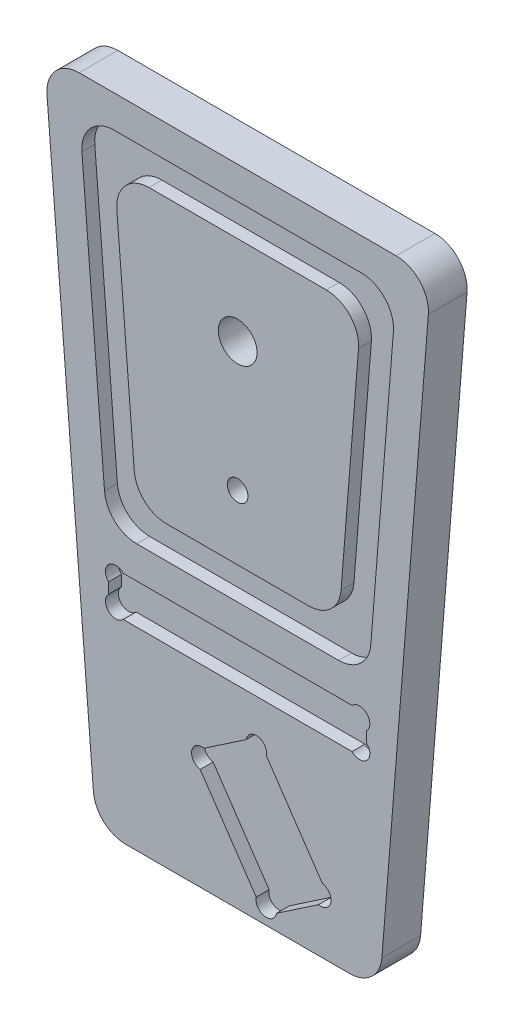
SolidWorks part; units mm, degrees
ref_plane "Plan de face" through (0, 0, 0) normal (0, 0, 1) x (1, 0, 0)
ref_plane "Plan de dessus" through (0, 0, 0) normal (0, 1, 0) x (1, 0, 0)
ref_plane "Plan de droite" through (0, 0, 0) normal (1, 0, 0) x (0, 0, -1)
sketch "Esquisse1" plane through (0, 0, 0) normal (0, 0, 1) x (1, 0, 0)
  line L0 (-22, -40) -> (-30, 60)
  line L1 (-30, 60) -> (30, 60)
  line L2 (0, -55) -> (0, 55) construction
  line L3 (-22, -40) -> (22, -40)
  line L4 (0, 70) -> (0, -50) construction
  line L5 (22, -40) -> (30, 60)
  point P10 (0, -40)
  point P11 (0, 60)
  dimension "D1" = 30
  dimension "D2" = 22
  dimension "D3" = 100
extrude "Extrusion1" add sketch "Esquisse1" along normal blind 6
fillet "Congé1" radius 5 3 edges at (-22, -40, 3) (-30, 60, 3) (30, 60, 3)
sketch "Esquisse3" plane through (0, 0, 6) normal (0, 0, 1) x (1, 0, 0)
  line L0 (20, -3.8) -> (-20, -3.8)
  line L1 (-20, -3.8) -> (-20, -10)
  line L2 (-20, -10) -> (20, -10)
  line L3 (-17.384, -40) -> (22, -40) construction
  line L4 (0, 70) -> (0, -50) construction
  line L5 (20, -3.8) -> (20, -10)
  point P10 (0, -10)
  point P11 (0, -3.8)
  dimension "D1" = 30
  dimension "D2" = 6.2
  dimension "D3" = 20
extrude "Enlèv. mat.-Extru.1" cut sketch "Esquisse3" against normal blind 2
sketch "Esquisse5" plane through (0, 0, 6) normal (0, 0, 1) x (1, 0, 0)
  line L0 (24.584, 55) -> (-24.584, 55)
  line L1 (-24.584, 55) -> (-20.28, 1.2)
  line L2 (-20.28, 1.2) -> (20.28, 1.2)
  line L3 (19.1681, 50) -> (-19.1681, 50)
  line L4 (-19.1681, 50) -> (-15.6641, 6.2)
  line L5 (-15.6641, 6.2) -> (15.6641, 6.2)
  line L6 (24.584, 60) -> (-24.584, 60) construction
  line L7 (-29.5681, 54.6013) -> (-22.3681, -35.3987) construction
  line L9 (20, -3.8) -> (-20, -3.8) construction
  line L10 (0, 70) -> (0, -50) construction
  line L11 (19.1681, 50) -> (15.6641, 6.2)
  line L12 (24.584, 55) -> (20.28, 1.2)
  point P19 (0, 6.2)
  point P20 (0, 50)
  point P21 (0, 1.2)
  point P22 (0, 55)
  dimension "D1" = 5
  dimension "D2" = 5
  dimension "D3" = 5
  dimension "D4" = 5
  dimension "D5" = 5
  dimension "D6" = 5
  dimension "D7" = 5
  dimension "D8" = 5
extrude "Enlèv. mat.-Extru.3" cut sketch "Esquisse5" against normal blind 2
fillet "Congé2" radius 5 8 edges at (-20.28, 1.2, 5) (-24.584, 55, 5) (24.584, 55, 5) (20.28, 1.2, 5) (-19.1681, 50, 5) (19.1681, 50, 5) (15.6641, 6.2, 5) (-15.6641, 6.2, 5)
sketch "Esquisse4" plane through (0, 0, 6) normal (0, 0, 1) x (1, 0, 0)
  line L0 (20, -3.8) -> (-20, -3.8) construction
  circle A0 centre (0, 16.2) radius 1.6
  circle A1 centre (0, 36.2) radius 3
  dimension "D1" = 6
  dimension "D2" = 3.2
  dimension "D3" = 20
  dimension "D4" = 40
extrude "Enlèv. mat.-Extru.2" cut sketch "Esquisse4" against normal blind 6
sketch "Esquisse6" plane through (0, 0, 6) normal (0, 0, 1) x (1, 0, 0)
  line L0 (-7.0801, -22.3005) -> (3.1805, -15.3379)
  line L1 (3.1805, -15.3379) -> (14.4107, -31.8873)
  line L2 (14.4107, -31.8873) -> (4.15, -38.85)
  line L3 (4.15, -38.85) -> (-7.0801, -22.3005)
  line L4 (-17.384, -40) -> (22, -40) construction
  line L5 (3.1805, -15.3379) -> (4.15, -38.85) construction
  line L6 (14.4107, -31.8873) -> (-7.0801, -22.3005) construction
  dimension "D1" = 12.4
  dimension "D2" = 20
  dimension "D3" = 90
  dimension "D4" = 90
  dimension "D5" = 90
  dimension "D6" = 55.84
  dimension "D7" = 17.85
  dimension "D8" = 1.15
extrude "Enlèv. mat.-Extru.8" cut sketch "Esquisse6" against normal blind 2
fillet "Congé3" radius 5 1 edges at (22, -40, 3)
sketch "Esquisse8" plane through (0, 0, 6) normal (0, 0, 1) x (1, 0, 0)
  line L0 (-20, -3.8) -> (-20, -10) construction
  line L1 (20, -3.8) -> (-20, -3.8) construction
  line L2 (-20, -10) -> (20, -10) construction
  line L3 (20, -10) -> (20, -3.8) construction
  line L4 (14.4107, -31.8873) -> (3.1805, -15.3379) construction
  line L5 (-7.0801, -22.3005) -> (4.15, -38.85) construction
  line L6 (4.15, -38.85) -> (14.4107, -31.8873) construction
  line L7 (3.1805, -15.3379) -> (-7.0801, -22.3005) construction
  circle A0 centre (-18.9, -4.9) radius 1.6
  circle A1 centre (-18.9, -8.9) radius 1.6
  circle A2 centre (18.9, -4.9) radius 1.6
  circle A3 centre (18.9, -8.9) radius 1.6
  circle A4 centre (2.888, -16.8657) radius 1.6
  circle A5 centre (-5.5522, -22.5931) radius 1.6
  circle A6 centre (4.4426, -37.3221) radius 1.6
  circle A7 centre (12.8828, -31.5948) radius 1.6
  dimension "D5" = 1.1
  dimension "D9" = 1.1
  dimension "D1" = 1.1
  dimension "D2" = 1.1
  dimension "D3" = 1.1
  dimension "D4" = 1.1
  dimension "D6" = 1.1
  dimension "D7" = 1.1
  dimension "D8" = 1.1
  dimension "D10" = 1.1
  dimension "D11" = 1.1
  dimension "D12" = 1.1
  dimension "D13" = 1.1
  dimension "D14" = 1.1
  dimension "D15" = 1.1
  dimension "D16" = 1.1
extrude "Enlèv. mat.-Extru.9" cut sketch "Esquisse8" against normal blind 2
